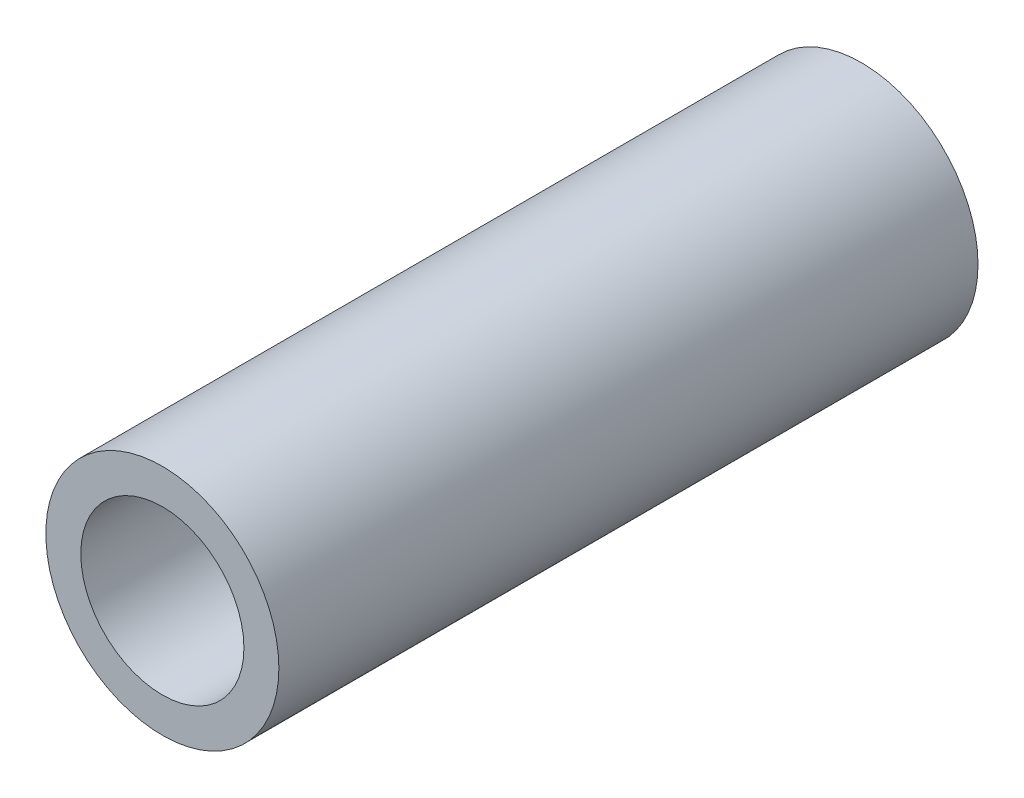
SolidWorks part; units mm, degrees
ref_plane "Ebene vorne" through (0, 0, 0) normal (0, 0, 1) x (1, 0, 0)
ref_plane "Ebene oben" through (0, 0, 0) normal (0, 1, 0) x (1, 0, 0)
ref_plane "Ebene rechts" through (0, 0, 0) normal (1, 0, 0) x (0, 0, -1)
sketch "Skizze1" plane through (0, 0, 0) normal (0, 0, 1) x (1, 0, 0)
  circle A0 centre (0, 0) radius 10
  circle A1 centre (0, 0) radius 7
  dimension "D1" = 20
  dimension "D2" = 14
extrude "Aufsatz-Linear austragen1" add sketch "Skizze1" along normal blind 60
